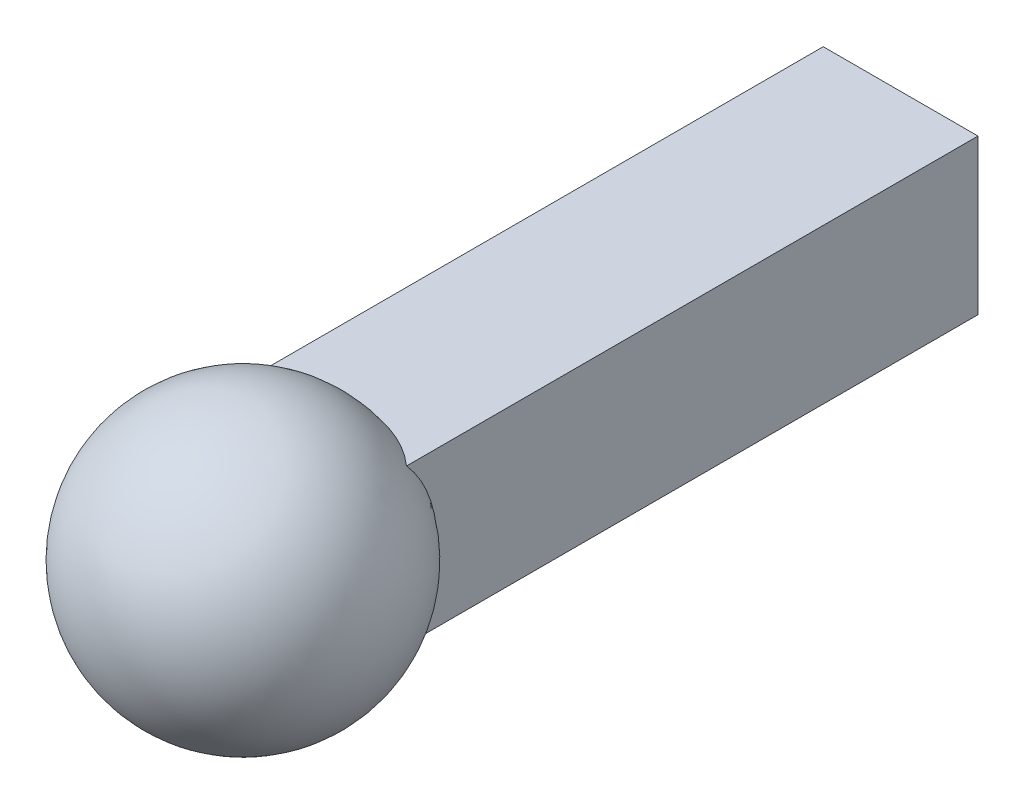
SolidWorks part; units mm, degrees
ref_plane "Alzado" through (0, 0, 0) normal (0, 0, 1) x (1, 0, 0)
ref_plane "Planta" through (0, 0, 0) normal (0, 1, 0) x (1, 0, 0)
ref_plane "Vista lateral" through (0, 0, 0) normal (1, 0, 0) x (0, 0, -1)
sketch "Croquis6" plane through (0, 0, 0) normal (1, 0, 0) x (0, 0, -1)
  line L0 (0, 9) -> (0, -9)
  arc A0 (0, -9) -> (0, 9) centre (0, 0) ccw
  dimension "D1" = 9
revolve "Revolución19" add sketch "Croquis6" angle 360 about L0
sketch "Croquis8" plane through (0, 0, 0) normal (0, 1, 0) x (1, 0, 0)
  line L0 (0, 0) -> (0, 42.5) construction
  line L2 (0, 42.5) -> (-5, 42.5) construction
  line L4 (-1.188, 32.1305) -> (-1.188, 31.6837) construction
sketch3d "Croquis3D2"
  line L0 (-5, 0, -42.5) -> (-5, -5, -42.5)
  line L3 (0, 0, -42.5) -> (-5, 0, -42.5) construction
  line L4 (-5, 0, -42.5) -> (-5, 5, -42.5)
  line L5 (-5, 5, -42.5) -> (5, 5, -42.5)
  line L6 (5, 5, -42.5) -> (5, -5, -42.5)
  line L7 (5, -5, -42.5) -> (-5, -5, -42.5)
  point P5 (-5, -0.8973, -42.5)
sketch "Croquis9" plane through (0, 0, 0) normal (0, 0, 1) x (1, 0, 0)
  line L0 (-5, 5) -> (-5, -5)
  line L1 (-5, -5) -> (5, -5)
  line L2 (5, -5) -> (5, 5)
  line L3 (5, 5) -> (-5, 5)
extrude "Saliente-Extruir5" add sketch "Croquis9" against normal blind 42.5
